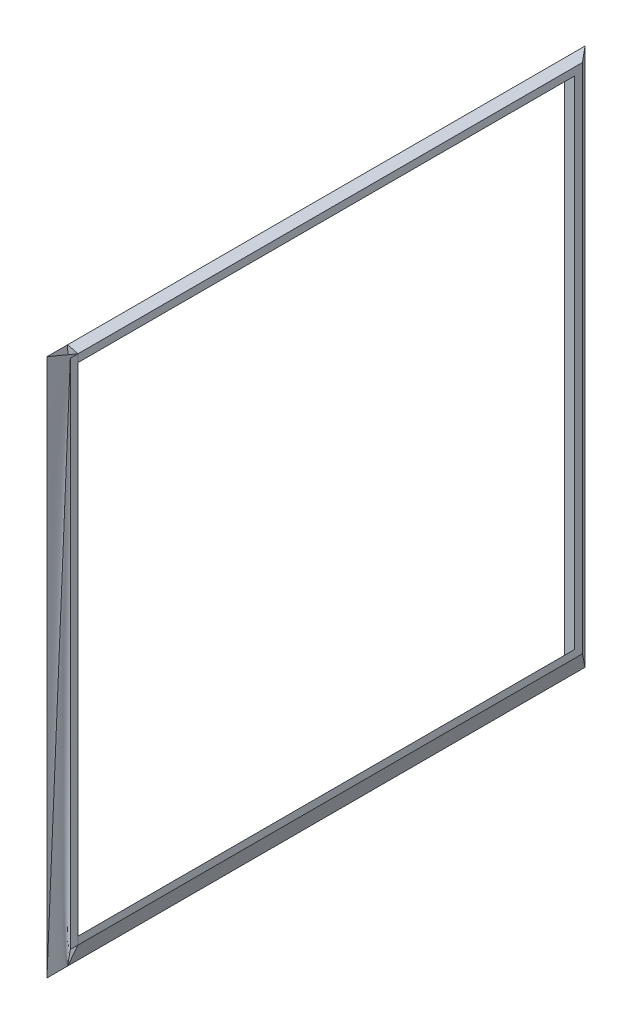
SolidWorks part; units mm, degrees
ref_plane "Front Plane" through (0, 0, 0) normal (1, 0, 0) x (0, 1, 0)
ref_plane "Top Plane" through (0, 0, 0) normal (0, 0, 1) x (0, 1, 0)
ref_plane "Right Plane" through (0, 0, 0) normal (0, 1, 0) x (-1, 0, 0)
sketch "Sketch1" plane through (0, 0, 0) normal (1, 0, 0) x (0, 1, 0)
  line L0 (-82.55, 76.2) -> (82.55, 76.2)
  line L1 (82.55, 76.2) -> (82.55, 82.55)
  line L2 (82.55, 82.55) -> (-82.55, 82.55)
  line L3 (-82.55, 82.55) -> (-82.55, 76.2)
ref_plane "Plane1" through (3.175, 0, 0) normal (1, 0, 0) x (0, 1, 0)
sketch "Sketch2" plane through (3.175, 0, 0) normal (1, 0, 0) x (0, 1, 0)
  line L0 (-75.3872, 76.2) -> (81.7372, 76.2)
  line L1 (81.7372, 76.2) -> (81.7372, 78.5622)
  line L2 (81.7372, 78.5622) -> (-75.3872, 78.5622)
  line L3 (-75.3872, 78.5622) -> (-75.3872, 76.2)
loft "Gap_bridge_0" add profiles "Sketch1", "Sketch2"
sketch "Sketch3" plane through (0, 0, 0) normal (1, 0, 0) x (0, 1, 0)
  line L0 (-82.55, -82.55) -> (82.55, -82.55)
  line L1 (82.55, -82.55) -> (82.55, -76.2)
  line L2 (82.55, -76.2) -> (-82.55, -76.2)
  line L3 (-82.55, -76.2) -> (-82.55, -82.55)
ref_plane "Plane2" through (3.175, 0, 0) normal (1, 0, 0) x (0, 1, 0)
sketch "Sketch4" plane through (3.175, 0, 0) normal (1, 0, 0) x (0, 1, 0)
  line L0 (-75.3872, -78.5622) -> (81.7372, -78.5622)
  line L1 (81.7372, -78.5622) -> (81.7372, -76.2)
  line L2 (81.7372, -76.2) -> (-75.3872, -76.2)
  line L3 (-75.3872, -76.2) -> (-75.3872, -78.5622)
loft "Gap_bridge_1" add profiles "Sketch3", "Sketch4"
sketch "Sketch5" plane through (0, 0, 0) normal (1, 0, 0) x (0, 1, 0)
  line L0 (76.2, -76.2) -> (82.55, -76.2)
  line L1 (82.55, -76.2) -> (82.55, 76.2)
  line L2 (82.55, 76.2) -> (76.2, 76.2)
  line L3 (76.2, 76.2) -> (76.2, -76.2)
ref_plane "Plane3" through (3.175, 0, 0) normal (1, 0, 0) x (0, 1, 0)
sketch "Sketch6" plane through (3.175, 0, 0) normal (1, 0, 0) x (0, 1, 0)
  line L0 (79.375, -76.2) -> (81.7372, -76.2)
  line L1 (81.7372, -76.2) -> (81.7372, 76.2)
  line L2 (81.7372, 76.2) -> (79.375, 76.2)
  line L3 (79.375, 76.2) -> (79.375, -76.2)
loft "Gap_bridge_2" add profiles "Sketch5", "Sketch6"
sketch "Sketch7" plane through (0, 0, 0) normal (1, 0, 0) x (0, 1, 0)
  line L0 (-82.55, -76.2) -> (-76.2, -76.2)
  line L1 (-76.2, -76.2) -> (-76.2, 76.2)
  line L2 (-76.2, 76.2) -> (-82.55, 76.2)
  line L3 (-82.55, 76.2) -> (-82.55, -76.2)
ref_plane "Plane4" through (3.175, 0, 0) normal (1, 0, 0) x (0, 1, 0)
sketch "Sketch8" plane through (3.175, 0, 0) normal (1, 0, 0) x (0, 1, 0)
  line L0 (-75.3872, -76.2) -> (-73.025, -76.2)
  line L1 (-73.025, -76.2) -> (-73.025, 76.2)
  line L2 (-73.025, 76.2) -> (-75.3872, 76.2)
  line L3 (-75.3872, 76.2) -> (-75.3872, -76.2)
loft "Gap_bridge_3" add profiles "Sketch7", "Sketch8"
